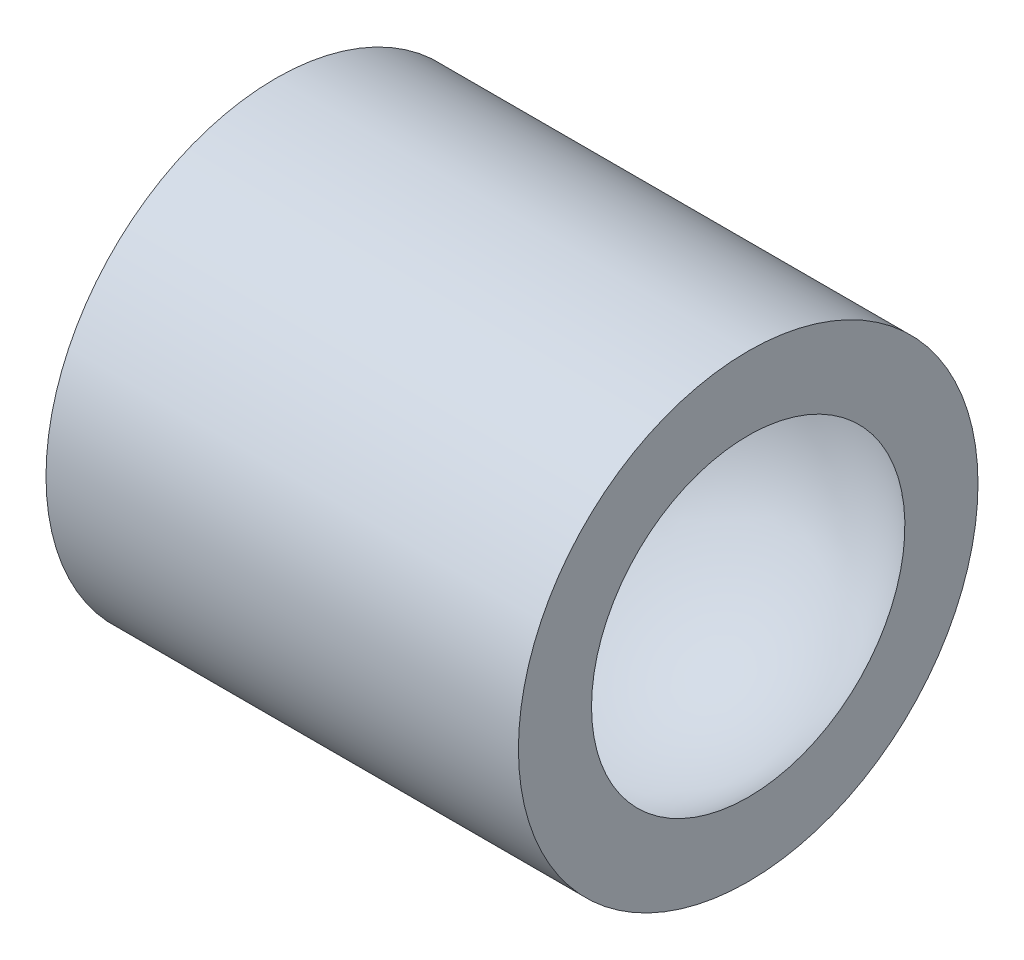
SolidWorks part; units mm, degrees
ref_plane "Ebene vorne" through (0, 0, 0) normal (0, 0, 1) x (1, 0, 0)
ref_plane "Ebene oben" through (0, 0, 0) normal (0, 1, 0) x (1, 0, 0)
ref_plane "Ebene rechts" through (0, 0, 0) normal (1, 0, 0) x (0, 0, -1)
sketch "Skizze1" plane through (0, 0, 0) normal (0, 0, 1) x (1, 0, 0)
  line L0 (0, 0) -> (75.6041, 0) construction
  line L1 (33.0719, 37.5) -> (33.0719, 55)
  line L2 (-80, 55) -> (-80, 0)
  line L3 (-80, 0) -> (-50, 0)
  line L5 (33.0719, 55) -> (-80, 55)
  arc A0 (33.0719, 37.5) -> (-50, 0) centre (0, 0) ccw
  dimension "D1" = 100
  dimension "D2" = 110
  dimension "D3" = 80
  dimension "D4" = 75
revolve "Rotation1" add sketch "Skizze1" angle 360 about L0
sketch "Skizze2" plane through (0, 0, 0) normal (0, 0, 1) x (1, 0, 0)
  line L0 (0, 0) -> (0, -91.992) construction
ref_plane "Ebene1" through (0, 0, 0) normal (-0.5, 0, 0.866) x (0.866, 0, 0.5)
